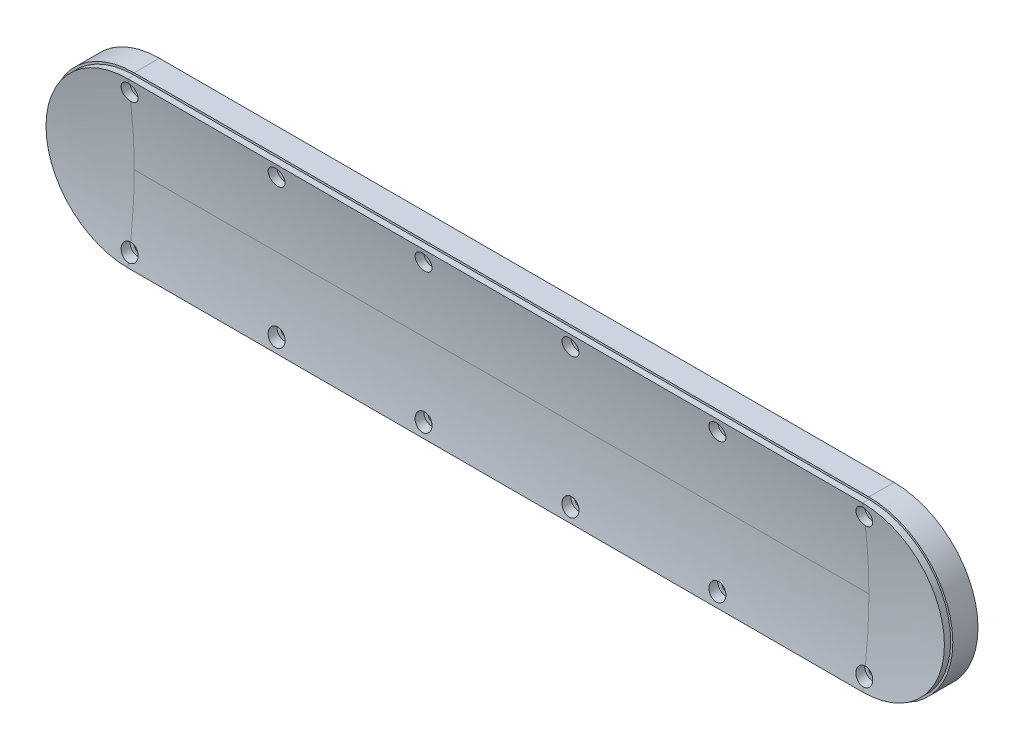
SolidWorks part; units mm, degrees
ref_plane "Płaszczyzna przednia" through (0, 0, 0) normal (0, 0, 1) x (1, 0, 0)
ref_plane "Płaszczyzna górna" through (0, 0, 0) normal (0, 1, 0) x (1, 0, 0)
ref_plane "Płaszczyzna prawa" through (0, 0, 0) normal (1, 0, 0) x (0, 0, -1)
sketch "Szkic1" plane through (0, 0, 0) normal (0, 0, 1) x (1, 0, 0)
  line L0 (-168.7568, 8.9276) -> (181.2432, 8.9276)
  line L1 (-168.7568, -71.0724) -> (181.2432, -71.0724)
  arc A0 (-168.7568, 8.9276) -> (-168.7568, -71.0724) centre (-168.7568, -31.0724) ccw
  arc A1 (181.2432, -71.0724) -> (181.2432, 8.9276) centre (181.2432, -31.0724) ccw
extrude "Dodanie-wyciągnięcie1" add sketch "Szkic1" along normal blind 12
sketch "Szkic2" plane through (0, 0, 12) normal (0, 0, 1) x (1, 0, 0)
  line L0 (181.2432, -70.0724) -> (-168.7568, -70.0724)
  line L1 (-168.7568, 7.9276) -> (181.2432, 7.9276)
  arc A0 (181.2432, -70.0724) -> (181.2432, 7.9276) centre (181.2432, -31.0724) ccw
  arc A1 (-168.7568, 7.9276) -> (-168.7568, -70.0724) centre (-168.7568, -31.0724) ccw
extrude "Dodanie-wyciągnięcie2" add sketch "Szkic2" along normal blind 3
ref_plane "Płaszczyzna1" through (181.2432, 0, 0) normal (-1, 0, 0) x (0, 0, 1)
ref_plane "Płaszczyzna2" through (-168.7568, 0, 0) normal (-1, 0, 0) x (0, 0, 1)
sketch "Szkic4" plane through (-168.7568, 0, 0) normal (-1, 0, 0) x (0, 0, 1)
  line L0 (15, -31.0724) -> (12, -31.0724) construction
  line L1 (15, -70.0724) -> (15, 7.9276) construction
  line L2 (12, -70.0724) -> (12, 7.9276) construction
  line L3 (15, -70.0724) -> (15, -31.0724)
  line L4 (15, -70.0724) -> (12, -70.0724) construction
  line L5 (12, -31.0724) -> (15, -31.0724)
  spline S0 degree 2 poles (15, -70.0724) (11.9845, -50.6873) (12, -31.0724) knots 0 0 0 1 1 1
  point P8 (13.5, -70.0724)
  dimension "D1" = 20
  dimension "D2" = 2.3
revolve "Wycięcie-obrót1" cut sketch "Szkic4" angle 360 about L0
sketch "Szkic6" plane through (-168.7568, 0, 0) normal (-1, 0, 0) x (0, 0, 1)
  line L0 (15, -31.0724) -> (12, -31.0724) construction
  line L1 (15, 7.9276) -> (15, -70.0724) construction
  line L2 (12, -71.0724) -> (12, 8.9276) construction
  line L3 (15, -70.0724) -> (12, -70.0724) construction
  line L4 (15, -70.0724) -> (15, 7.9276)
  line L5 (15, -31.0724) -> (12, -31.0724)
  spline S0 degree 2 poles (15, -70.0724) (11.9845, -50.6873) (12, -31.0724) knots 0 0 0 1 1 1
  spline S1 degree 2 poles (15, 7.9276) (11.9845, -11.4575) (12, -31.0724) knots 0 0 0 1 1 1
  point P8 (13.5, -70.0724)
  dimension "D1" = 2.3
  dimension "D2" = 20
extrude "Wytnij-wyciągnięcie1" cut sketch "Szkic6" along direction (1, 0, 0) on the side against the normal blind 350 contours S0 L4 S1
sketch "Szkic8" plane through (181.2432, 0, 0) normal (-1, 0, 0) x (0, 0, 1)
  line L0 (12, -71.0724) -> (12, 8.9276) construction
  line L1 (15, -70.0724) -> (15, 7.9276) construction
  line L2 (15, -70.0724) -> (12, -70.0724) construction
  line L3 (15, -70.0724) -> (15, -31.0724)
  line L4 (12, -31.0724) -> (15, -31.0724)
  spline S0 degree 2 poles (15, -70.0724) (11.9845, -50.6873) (12, -31.0724) knots 0 0 0 1 1 1
  dimension "D1" = 2.3
  dimension "D2" = 20
revolve "Wycięcie-obrót2" cut sketch "Szkic8" angle 360 about L4
ref_plane "Płaszczyzna4" through (0, 0, 10) normal (0, 0, 1) x (1, 0, 0)
sketch "Szkic9" plane through (0, 0, 10) normal (0, 0, 1) x (1, 0, 0)
  line L0 (181.2432, 6.6) -> (181.2432, -6.6) construction
  line L1 (-168.7568, -70.0724) -> (181.2432, -70.0724) construction
  circle A0 centre (181.2432, -64.0724) radius 2
  point P0 (181.2432, -64.0724)
  dimension "D1" = 6
extrude "Wytnij-wyciągnięcie2" cut sketch "Szkic9" against normal up to next and the other way up to next
pattern_linear "Szyk liniowy1" count 6 spacing 70 along (-1, 0, 0) of "Wytnij-wyciągnięcie2"
ref_plane "Płaszczyzna5" through (0, -71.0724, 0) normal (0, 1, 0) x (1, 0, 0)
ref_plane "Płaszczyzna6" through (0, -31.0724, 0) normal (0, 1, 0) x (1, 0, 0)
mirror "Lustro1" about plane through (0, -31.0724, 0) normal (0, 1, 0) of "Szyk liniowy1", "Wytnij-wyciągnięcie2"
sketch "Szkic10" plane through (0, 0, 10) normal (0, 0, 1) x (1, 0, 0)
  circle A0 centre (181.2432, -64.0724) radius 4
extrude "Wytnij-wyciągnięcie3" cut sketch "Szkic10" along normal through all
pattern_linear "Szyk liniowy2" count 6 spacing 70 along (-1, 0, 0) of "Wytnij-wyciągnięcie3"
mirror "Lustro2" about plane through (0, -31.0724, 0) normal (0, 1, 0) of "Szyk liniowy2", "Wytnij-wyciągnięcie3"
